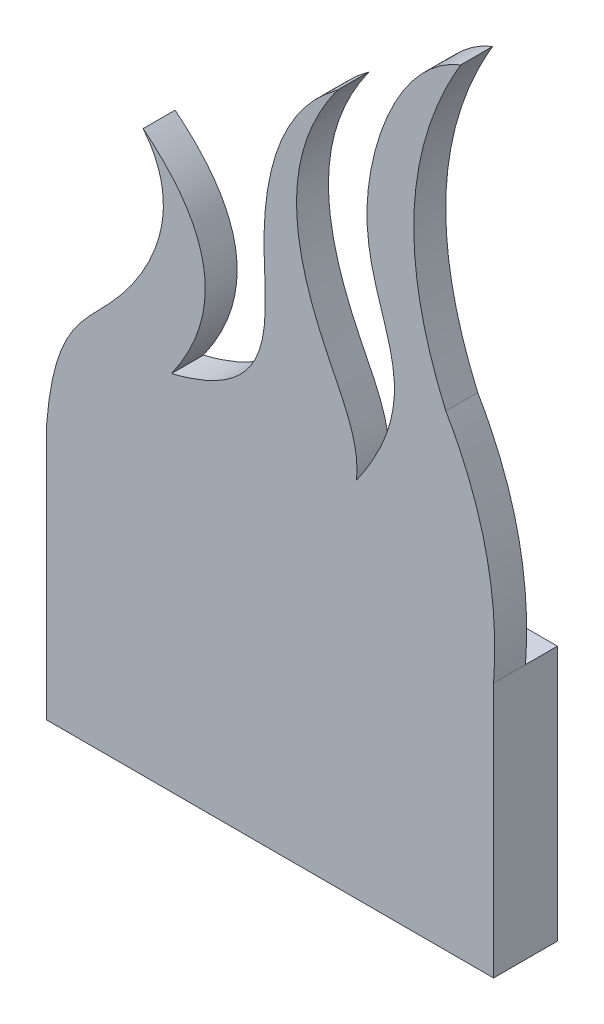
SolidWorks part; units mm, degrees
ref_plane "Front Plane" through (0, 0, 0) normal (0, 0, 1) x (1, 0, 0)
ref_plane "Top Plane" through (0, 0, 0) normal (0, 1, 0) x (1, 0, 0)
ref_plane "Right Plane" through (0, 0, 0) normal (1, 0, 0) x (0, 0, -1)
sketch "Sketch1" plane through (0, 0, 0) normal (0, 1, 0) x (1, 0, 0)
  line L1 (-22.225, -3.175) -> (22.225, -3.175)
  line L2 (-22.225, -3.175) -> (-22.225, 3.175)
  line L3 (-22.225, 3.175) -> (22.225, 3.175)
  line L4 (22.225, -3.175) -> (22.225, 3.175)
  line L5 (-22.225, -3.175) -> (22.225, 3.175) construction
  line L6 (-22.225, 3.175) -> (22.225, -3.175) construction
  point P0 (0, 0)
extrude "Boss-Extrude1" add sketch "Sketch1" along normal blind 25.4
sketch "Sketch2" plane through (0, 0, 3.175) normal (0, 0, 1) x (1, 0, 0)
  line L1 (22.225, 25.4) -> (22.225, 0) construction
  line L5 (-22.225, 25.4) -> (22.225, 25.4)
  spline S0 degree 3 poles (-22.225, 25.4) (-21.4643, 34.8643) (-15.3059, 37.3798) (-8.2459, 50.3299) (-12.6199, 55.7228) knots 0 0 0 0 0.483877 1 1 1 1
  spline S1 degree 2 poles (-12.6199, 55.7228) (-1.8987, 47.177) (-9.8006, 36.0374) knots 0 0 0 1 1 1
  spline S2 degree 3 poles (-9.8006, 36.0374) (1.3443, 38.7799) (-2.4662, 51.7262) (1.1778, 64.6987) (6.6776, 68.6745) knots 0 0 0 0 0.510492 1 1 1 1
  spline S3 degree 3 poles (6.6776, 68.6745) (0.7899, 60.4671) (2.7175, 49.6184) (8.9771, 39.5089) (8.5937, 36.0374) knots 0 0 0 0 0.69804 1 1 1 1
  spline S4 degree 3 poles (8.5937, 36.0374) (16.531, 47.4204) (4.8859, 52.4212) (12.9014, 74.6241) (18.9607, 76.999) knots 0 0 0 0 0.608339 1 1 1 1
  spline S5 degree 2 poles (18.9607, 76.999) (10.4367, 62.5991) (17.4738, 46.4481) knots 0 0 0 1 1 1
  spline S6 degree 2 poles (22.225, 25.4) (23.0801, 36.8267) (17.4738, 46.4481) knots 0 0 0 1 1 1
extrude "Boss-Extrude3" add sketch "Sketch2" against normal blind 3.175
